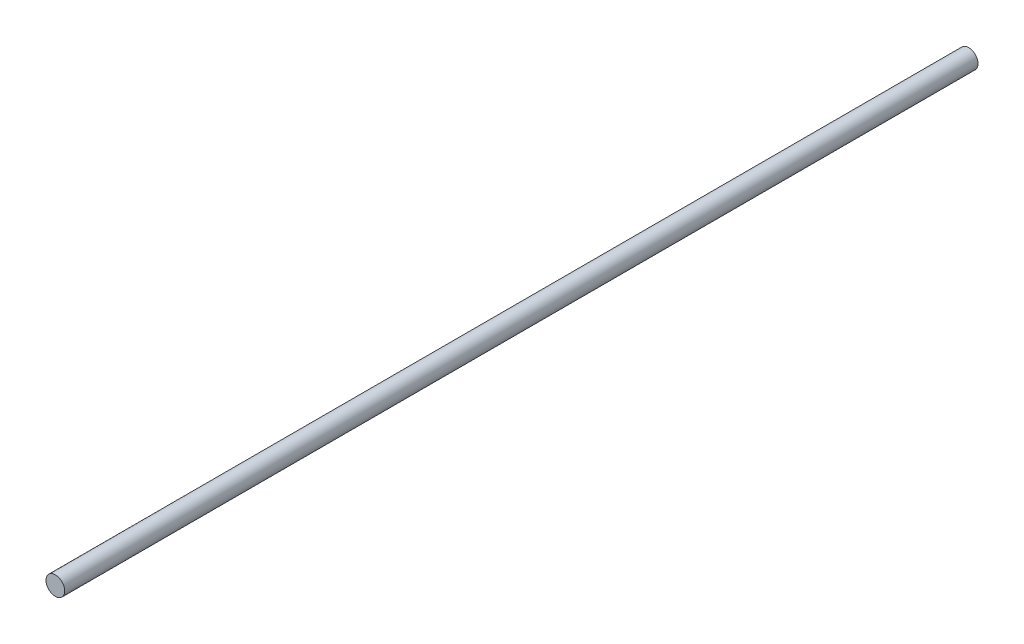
SolidWorks part; units mm, degrees
ref_plane "Alzado" through (0, 0, 0) normal (0, 0, 1) x (1, 0, 0)
ref_plane "Planta" through (0, 0, 0) normal (0, 1, 0) x (1, 0, 0)
ref_plane "Vista lateral" through (0, 0, 0) normal (1, 0, 0) x (0, 0, -1)
sketch "Sketch1" plane through (0, 0, 0) normal (0, 0, 1) x (1, 0, 0)
  circle A0 centre (0, 0) radius 4
  dimension "D1" = 8
extrude "Boss-Extrude1" add sketch "Sketch1" along normal mid plane 390
